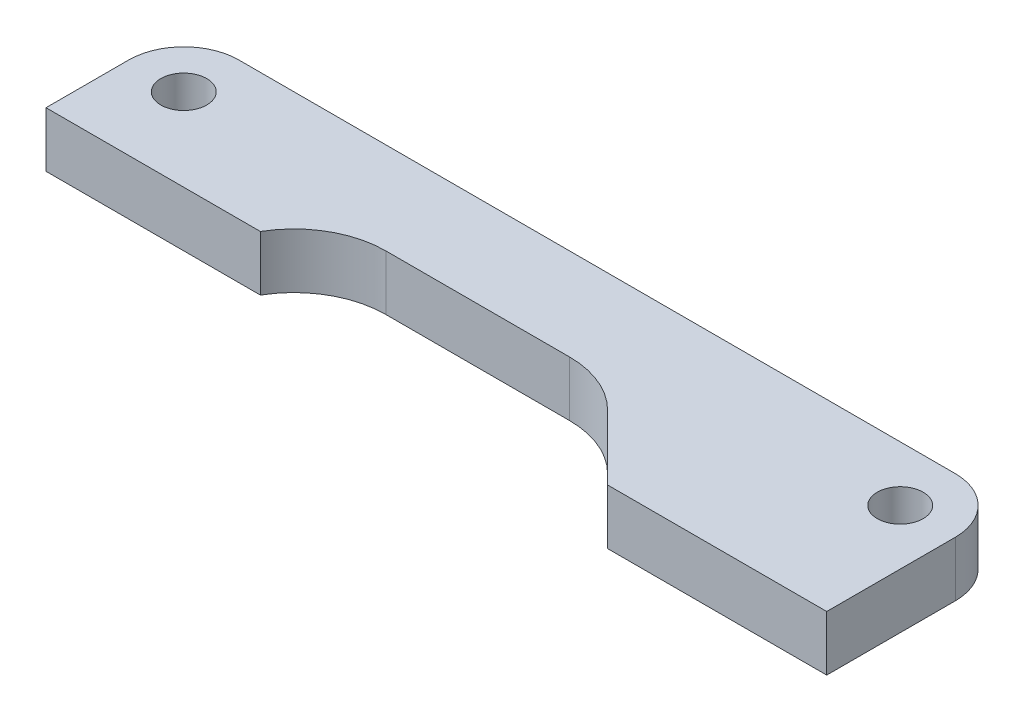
SolidWorks part; units mm, degrees
ref_plane "Front" through (0, 0, 0) normal (0, 0, 1) x (1, 0, 0)
ref_plane "Top" through (0, 0, 0) normal (0, 1, 0) x (1, 0, 0)
ref_plane "Right" through (0, 0, 0) normal (1, 0, 0) x (0, 0, -1)
sketch "Sketch1" plane through (0, 0, 0) normal (0, 1, 0) x (1, 0, 0)
  line L0 (0, 20) -> (90, 20) construction
  line L2 (0, 5) -> (0, 14)
  line L3 (6, 20) -> (84, 20)
  line L4 (90, 0) -> (90, 14)
  line L6 (0, 5) -> (23.3397, 5)
  line L7 (32, 10) -> (52, 10)
  line L8 (59.0711, 7.0711) -> (66.1421, 0)
  line L11 (66.1421, 0) -> (90, 0)
  line L14 (0, 5) -> (90, 5) construction
  arc A0 (32, 10) -> (23.3397, 5) centre (32, 0) ccw
  circle A1 centre (6, 14) radius 2.5
  arc A2 (59.0711, 7.0711) -> (52, 10) centre (52, 0) ccw
  circle A3 centre (84, 14) radius 2.5
  arc A4 (0, 14) -> (6, 20) centre (6, 14) cw
  arc A5 (90, 14) -> (84, 20) centre (84, 14) ccw
extrude "Extrude1" add sketch "Sketch1" along normal blind 6
